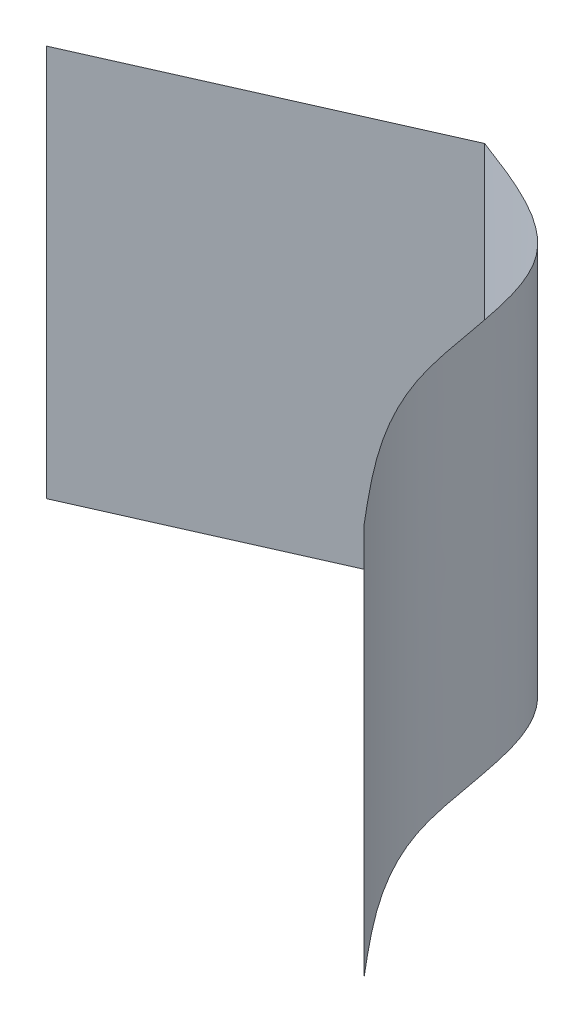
SolidWorks part; units mm, degrees
ref_plane "Front Plane" through (0, 0, 0) normal (0, 0, 1) x (1, 0, 0)
ref_plane "Top Plane" through (0, 0, 0) normal (0, 1, 0) x (1, 0, 0)
ref_plane "Right Plane" through (0, 0, 0) normal (1, 0, 0) x (0, 0, -1)
sketch "Sketch1" plane through (0, 0, 0) normal (0, 1, 0) x (1, 0, 0)
  line L0 (0, 0) -> (-98.7665, -43.8384)
surface "Surface-Extrude1" sketch "Sketch1" parameters "D1"=127.508
sketch "Sketch2" plane through (0, 0, 0) normal (0, 1, 0) x (1, 0, 0)
  spline S0 degree 3 poles (0, 0) (15.9736, -6.0459) (50.2627, -19.0242) (49.4492, -81.5393) (74.5545, -111.3245) (87.9418, -127.2074) knots 0 0 0 0 0.289303 0.621023 1 1 1 1
surface "Surface-Extrude2" sketch "Sketch2"
ref_plane "Plane1" through (0, 0, 319.2208) normal (0, 0, 1) x (1, 0, 0)
sketch "Sketch3" plane through (0, 0, 319.2208) normal (0, 0, 1) x (1, 0, 0)
  line L1 (-86.0795, 93.898) -> (75.8209, 93.898)
  line L2 (-86.0795, 93.898) -> (-86.0795, 26.2508)
  line L3 (-86.0795, 26.2508) -> (75.8209, 26.2508)
  line L4 (75.8209, 93.898) -> (75.8209, 26.2508)
